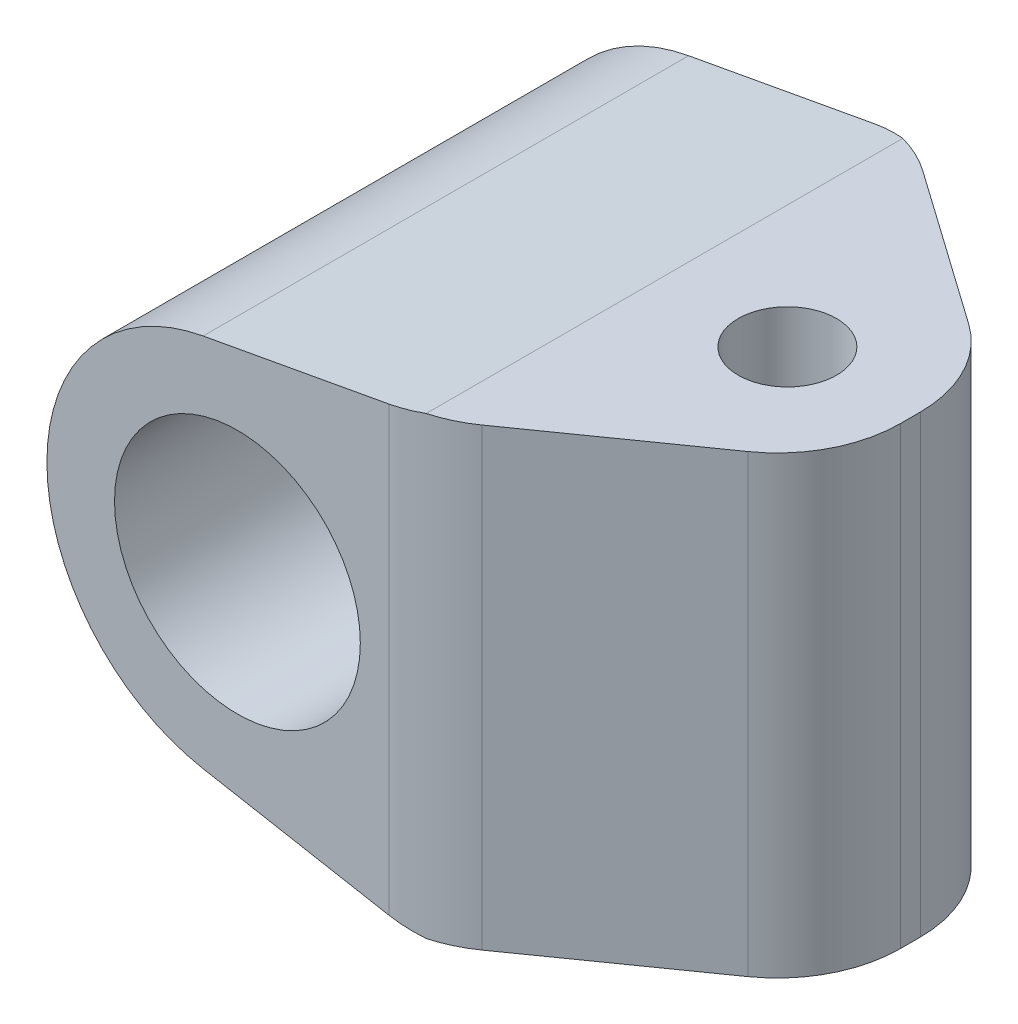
SolidWorks part; units mm, degrees
ref_plane "Plan1" through (0, 0, 0) normal (0, 0, 1) x (1, 0, 0)
ref_plane "Plan2" through (0, 0, 0) normal (0, 1, 0) x (1, 0, 0)
ref_plane "Plan3" through (0, 0, 0) normal (1, 0, 0) x (0, 0, -1)
sketch "Esquisse1" plane through (0, 0, 0) normal (0, 0, 1) x (1, 0, 0)
  line L0 (35, 18.5) -> (35, -18.5)
  line L1 (15, -18.5) -> (-2.7882, -15.2472)
  line L2 (15, 18.5) -> (-2.7882, 15.2472)
  line L3 (15, -18.5) -> (35, -18.5)
  line L4 (15, 18.5) -> (35, 18.5)
  circle A0 centre (0, 0) radius 10
  arc A1 (-2.7882, 15.2472) -> (-2.7882, -15.2472) centre (0, 0) ccw
  dimension "D1" = 20
  dimension "D2" = 31
  dimension "D3" = 37
  dimension "D4" = 18.5
  dimension "D5" = 35
  dimension "D6" = 20
extrude "Base-Extrusion" add sketch "Esquisse1" along normal mid plane 39.5
sketch "Esquisse2" plane through (-0.6014, 0, 0) normal (0, 1, 0) x (-1, 0, 0)
  line L0 (-0.6014, 19.75) -> (-0.6014, -19.75) construction
  line L1 (-18.693, 17.9226) -> (-31.3641, 8.9878)
  line L2 (-35.6014, 19.75) -> (-35.6014, -19.75) construction
  line L3 (-31.3641, -8.9878) -> (-18.693, -17.9226)
  line L4 (-15.6014, -19.75) -> (2.1868, -19.75) construction
  line L5 (-35.6014, 0.8152) -> (-35.6014, -0.8152)
  line L6 (-15.6014, 19.75) -> (2.1868, 19.75) construction
  line L7 (-12.9303, 19.75) -> (-5.1789, 19.75)
  line L8 (-12.9303, -19.75) -> (-6.1789, -19.75)
  circle A0 centre (-25.6014, 0) radius 4
  arc A1 (-18.693, 17.9226) -> (-12.9303, 19.75) centre (-12.9303, 9.75) cw
  arc A2 (-35.6014, 0.8152) -> (-31.3641, 8.9878) centre (-25.6014, 0.8152) cw
  arc A3 (-31.3641, -8.9878) -> (-35.6014, -0.8152) centre (-25.6014, -0.8152) cw
  arc A4 (-12.9303, -19.75) -> (-18.693, -17.9226) centre (-12.9303, -9.75) cw
  spline_without_curve S0
  point P18 (-16.1014, 19.75)
  point P21 (-35.6014, 6)
  point P24 (-35.6014, -6)
  point P27 (-16.1014, -19.75)
  dimension "D1" = 8
  dimension "D7" = 10
  dimension "D2" = 25
  dimension "D3" = 15.5
  dimension "D4" = 6
  dimension "D5" = 12
  dimension "D6" = 19.75
extrude "Enlèv. mat.-Extru.1" cut sketch "Esquisse2" against normal mid plane 40
